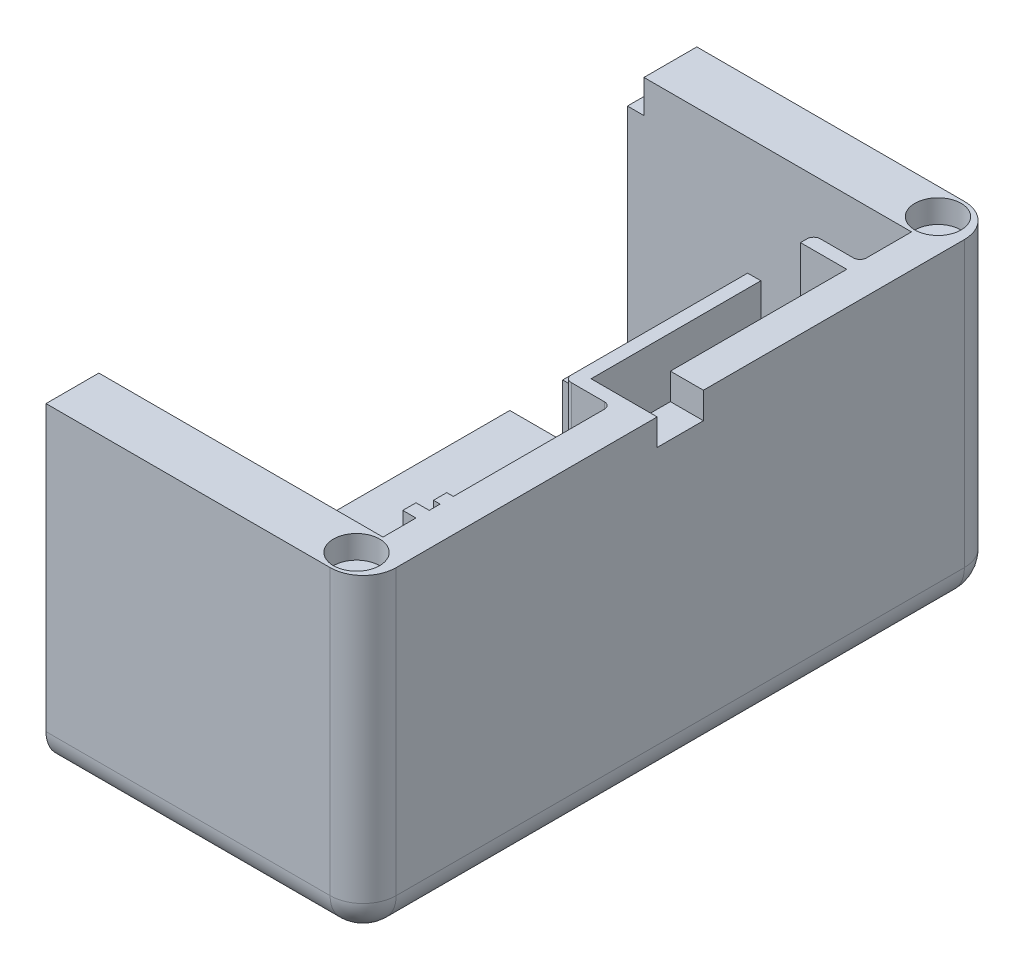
SolidWorks part; units mm, degrees
ref_plane "Piano frontale" through (0, 0, 0) normal (0, 0, 1) x (1, 0, 0)
ref_plane "Piano superiore" through (0, 0, 0) normal (0, 1, 0) x (1, 0, 0)
ref_plane "Piano destro" through (0, 0, 0) normal (1, 0, 0) x (0, 0, -1)
sketch "Sketch1" plane through (0, 0, 0) normal (0, 0, 1) x (1, 0, 0)
  line L1 (-22.553, -8.75) -> (25.447, -8.75)
  line L2 (-22.553, -8.75) -> (-22.553, 39.25)
  line L3 (-22.553, 39.25) -> (25.447, 39.25)
  line L4 (25.447, -8.75) -> (25.447, 39.25)
  dimension "D1" = 48
  dimension "D2" = 48
extrude "Boss-Extrude1" add sketch "Sketch1" along normal blind 8
sketch "Sketch2" plane through (0, 0, 8) normal (0, 0, 1) x (1, 0, 0)
  line L0 (-22.553, -8.75) -> (25.447, -8.75) construction
  line L1 (-22.553, -8.75) -> (25.447, -8.75)
  line L2 (-22.553, -8.75) -> (-22.553, -3.75)
  line L3 (-22.553, -3.75) -> (20.447, -3.75)
  line L4 (25.447, -8.75) -> (25.447, -3.75)
  line L5 (-22.553, 39.25) -> (-22.553, -8.75) construction
  line L6 (25.447, -8.75) -> (25.447, 39.25) construction
  line L7 (25.447, 39.25) -> (25.447, -3.75)
  line L9 (20.447, -3.75) -> (20.447, 39.25)
  line L10 (25.447, 39.25) -> (-22.553, 39.25) construction
  line L11 (20.447, 39.25) -> (25.447, 39.25)
  dimension "D1" = 5
  dimension "D2" = 5
extrude "Boss-Extrude2" add sketch "Sketch2" along normal blind 80
sketch "Sketch3" plane through (0, 0, 88) normal (0, 0, 1) x (1, 0, 0)
  line L0 (25.447, 39.25) -> (20.447, 39.25) construction
  line L1 (-22.553, -8.75) -> (25.447, -8.75)
  line L2 (-22.553, -8.75) -> (-22.553, 39.25)
  line L3 (-22.553, 39.25) -> (25.447, 39.25)
  line L4 (25.447, -8.75) -> (25.447, 39.25)
extrude "Boss-Extrude3" add sketch "Sketch3" along normal blind 8
fillet "Fillet1" radius 5 5 edges at (1.447, -8.75, 96) (25.447, -8.75, 48) (1.447, -8.75, 0) (25.447, 15.25, 96) (25.447, 15.25, 0)
sketch "Sketch4" plane through (25.447, 0, 0) normal (1, 0, 0) x (0, 0, -1)
  line L0 (-91, 39.25) -> (-5, 39.25) construction
  line L2 (-44.5, 39.25) -> (-51.5, 39.25)
  line L3 (-44.5, 39.25) -> (-44.5, 35.25)
  line L4 (-44.5, 35.25) -> (-51.5, 35.25)
  line L5 (-51.5, 39.25) -> (-51.5, 35.25)
  point P0 (-48, 39.25)
  dimension "D1" = 3.5
  dimension "D2" = 7
  dimension "D3" = 4
extrude "Cut-Extrude1" cut sketch "Sketch4" against normal blind 10
sketch "Sketch5" plane through (20.447, 0, 0) normal (-1, 0, 0) x (0, 0, 1)
  line L0 (51.5, 35.25) -> (44.5, 35.25) construction
  line L1 (48, 35.25) -> (48, 43.0761) construction
  line L2 (48, 43.0761) -> (48, 66.4757) construction
  line L3 (51.5, 39.25) -> (32.7393, 39.25) construction
  line L4 (88, 39.25) -> (51.5, 39.25) construction
  line L5 (44.5, 39.25) -> (8, 39.25) construction
  line L6 (51.5, 39.25) -> (51.5, 35.25) construction
  line L7 (51.5, 39.25) -> (17.8063, 39.25)
  line L8 (51.5, 39.25) -> (51.5, 30.25)
  line L9 (51.5, 30.25) -> (17.8063, 30.25)
  line L10 (17.8063, 39.25) -> (17.8063, 30.25)
  line L11 (53.5, 28.25) -> (15.8063, 28.25)
  line L12 (53.5, 28.25) -> (53.5, 39.25)
  line L13 (17.8063, 39.25) -> (15.8063, 39.25)
  line L14 (15.8063, 39.25) -> (15.8063, 28.25)
  line L15 (53.5, 41.25) -> (15.8063, 41.25) construction
  line L16 (53.5, 41.25) -> (53.5, 28.25) construction
  line L17 (15.8063, 41.25) -> (15.8063, 28.25) construction
  line L18 (51.5, 39.25) -> (53.5, 39.25)
  point P0 (48, 35.25)
  point P12 (48, 39.25)
  dimension "D1" = 9
  dimension "D2" = 0
  dimension "D3" = 2
extrude "Boss-Extrude4" add sketch "Sketch5" along normal blind 7 contours L14 L11 L12 L8 L9 L10 M6 M10 M11
sketch "Sketch6" plane through (0, 30.25, 0) normal (0, 1, 0) x (1, 0, 0)
  line L0 (13.447, -51.5) -> (20.447, -51.5) construction
  line L1 (13.447, -51.5) -> (15.447, -51.5)
  line L2 (13.447, -51.5) -> (13.447, -17.8063)
  line L3 (13.447, -17.8063) -> (15.447, -17.8063)
  line L4 (15.447, -51.5) -> (15.447, -17.8063)
  line L5 (13.447, -51.5) -> (13.447, -17.8063) construction
  line L6 (13.447, -17.8063) -> (20.447, -17.8063) construction
  dimension "D1" = 2
extrude "Boss-Extrude5" add sketch "Sketch6" along normal blind 9
sketch "Sketch8" plane through (13.447, 0, 0) normal (-1, 0, 0) x (0, 0, 1)
  line L0 (53.5, 39.25) -> (15.8063, 39.25) construction
  line L1 (17.8063, 39.25) -> (25.8063, 39.25)
  line L2 (53.5, 28.25) -> (15.8063, 28.25) construction
  line L3 (25.8063, 39.25) -> (17.8063, 39.25)
  line L4 (25.8063, 39.25) -> (25.8063, 30.25)
  line L7 (25.8063, 30.25) -> (17.8063, 30.25)
  line L8 (17.8063, 39.25) -> (17.8063, 30.25)
  dimension "D1" = 2
extrude "Cut-Extrude2" cut sketch "Sketch8" against normal blind 5 contours L8 L7 L4 M5
ref_plane "Plane3" through (8.3485, 8.3485, 0) normal (0.7071, 0.7071, 0) x (0.7071, -0.7071, 0)
mirror "Mirror1" about plane through (8.3485, 8.3485, 0) normal (0.7071, 0.7071, 0) of "Cut-Extrude2", "Boss-Extrude5", "Boss-Extrude4", "Cut-Extrude1"
sketch "Sketch12" plane through (0, 39.25, 0) normal (0, 1, 0) x (1, 0, 0)
  line L0 (20.447, -88) -> (20.447, -96) construction
  line L1 (20.447, -96) -> (-22.553, -96) construction
  circle A0 centre (20.447, -92) radius 3.5
  arc A2 (20.447, -96) -> (25.447, -91) centre (20.447, -91) ccw construction
  dimension "D1" = 7
  dimension "D2" = 0
  dimension "D3" = 4
extrude "Cut-Extrude9" cut sketch "Sketch12" against normal blind 3.5
mirror "Mirror2" about plane through (8.3485, 8.3485, 0) normal (0.7071, 0.7071, 0) of "Cut-Extrude9"
ref_plane "Plane5" through (0, 0, 48) normal (0, 0, 1) x (1, 0, 0)
mirror "Mirror3" about plane through (0, 0, 48) normal (0, 0, 1) of "Mirror2", "Cut-Extrude9"
sketch "Sketch13" plane through (0, 0, 0) normal (0, 0, -1) x (-1, 0, 0)
  line L1 (20.053, 39.25) -> (22.553, 39.25)
  line L2 (20.053, 39.25) -> (20.053, 34.25)
  line L3 (20.053, 34.25) -> (22.553, 34.25)
  line L4 (22.553, 39.25) -> (22.553, 34.25)
  line L6 (-20.447, 39.25) -> (22.553, 39.25) construction
extrude "Cut-Extrude10" cut sketch "Sketch13" against normal blind 10
extrude "Cut-Extrude12" cut sketch "Sketch16" along normal mid plane 45
sketch "Sketch16" plane through (50.7854, 4.5827, 73.6396) normal (0, 0, -1) x (-1, 0, 0)
  circle A0 centre (55.7284, 7.4873) radius 1.59
extrude "Cut-Extrude13" cut sketch "Sketch17" against normal blind 5
sketch "Sketch17" plane through (20.447, 73.9173, 45) normal (-1, 0, 0) x (0, 0, -1)
  line L1 (-38, 34.6673) -> (-36, 34.6673)
  line L2 (-38, 34.6673) -> (-38, 42.7933)
  line L3 (-38, 42.7933) -> (-36, 42.7933)
  line L4 (-36, 34.6673) -> (-36, 42.7933)
  line L5 (-34.35, 42.7933) -> (-32.35, 42.7933)
  line L6 (-34.35, 42.7933) -> (-34.35, 34.6673)
  line L7 (-34.35, 34.6673) -> (-32.35, 34.6673)
  line L8 (-32.35, 42.7933) -> (-32.35, 34.6673)
sketch "Sketch18" plane through (0, 0, 88) normal (0, 0, -1) x (-1, 0, 0)
  circle A0 centre (4.943, 12.07) radius 1.59
extrude "Boss-Extrude6" add sketch "Sketch18" against normal blind 5
sketch "Sketch19" plane through (20.447, 0, 0) normal (-1, 0, 0) x (0, 0, 1)
  line L1 (83, 31.124) -> (81, 31.124)
  line L2 (83, 31.124) -> (83, 39.25)
  line L3 (83, 39.25) -> (81, 39.25)
  line L4 (81, 31.124) -> (81, 39.25)
extrude "Boss-Extrude7" add sketch "Sketch19" along normal blind 2 and the other way blind 5
sketch "Sketch20" plane through (20.447, 0, 0) normal (-1, 0, 0) x (0, 0, 1)
  line L1 (79.35, 31.124) -> (77.35, 31.124)
  line L2 (79.35, 31.124) -> (79.35, 39.25)
  line L3 (79.35, 39.25) -> (77.35, 39.25)
  line L4 (77.35, 31.124) -> (77.35, 39.25)
extrude "Boss-Extrude8" add sketch "Sketch20" along normal blind 1 and the other way blind 5
fillet "Fillet2" radius 1 8 edges at (-17.053, -3.75, 15.8063) (-11.553, -0.25, 15.8063) (-17.053, 3.25, 15.8063) (-11.553, 3.25, 34.6531) (-11.553, -3.75, 34.6531) (-11.553, -0.25, 53.5) (-17.053, 3.25, 53.5) (-17.053, -3.75, 53.5)
fillet "Fillet3" radius 1 7 edges at (20.447, 33.75, 15.8063) (13.447, 33.75, 15.8063) (20.447, 28.25, 34.6531) (13.447, 28.25, 34.6531) (13.447, 33.75, 53.5) (16.947, 28.25, 53.5) (20.447, 33.75, 53.5)
sketch "Sketch21" plane through (0, 0, 96) normal (0, 0, 1) x (1, 0, 0)
  circle A0 centre (-4.943, 12.07) radius 1.59
extrude "Boss-Extrude9" add sketch "Sketch21" against normal up to next
equation "\"ir_lenght\"= 5"
equation "\"ir_width\"= 10"
equation "\"D3@Sketch13\"=\"ir_lenght\"/2"
equation "\"D2@Sketch13\"=\"ir_width\"/2"
